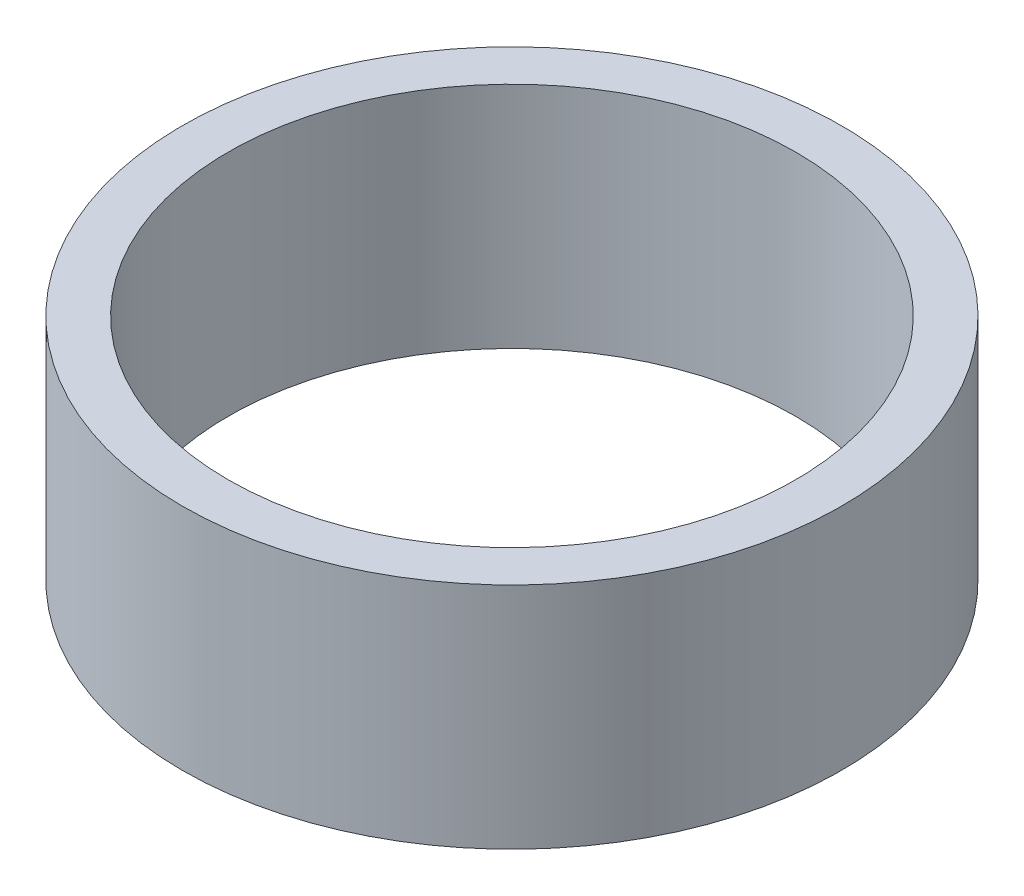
SolidWorks part; units mm, degrees
ref_plane "Plan de face" through (0, 0, 0) normal (0, 0, 1) x (1, 0, 0)
ref_plane "Plan de dessus" through (0, 0, 0) normal (0, 1, 0) x (1, 0, 0)
ref_plane "Plan de droite" through (0, 0, 0) normal (1, 0, 0) x (0, 0, -1)
sketch "Esquisse1" plane through (0, 0, 0) normal (0, 1, 0) x (1, 0, 0)
  line L0 (0, 0) -> (68.1408, -68.1408) construction
  line L1 (0, 0) -> (0, -68.5206) construction
  circle A0 centre (0, 0) radius 36
  circle A1 centre (0, 0) radius 31
  dimension "D1" = 72
  dimension "D3" = 45
  dimension "D2" = 5
extrude "Boss.-Extru.1" add sketch "Esquisse1" along normal blind 25
